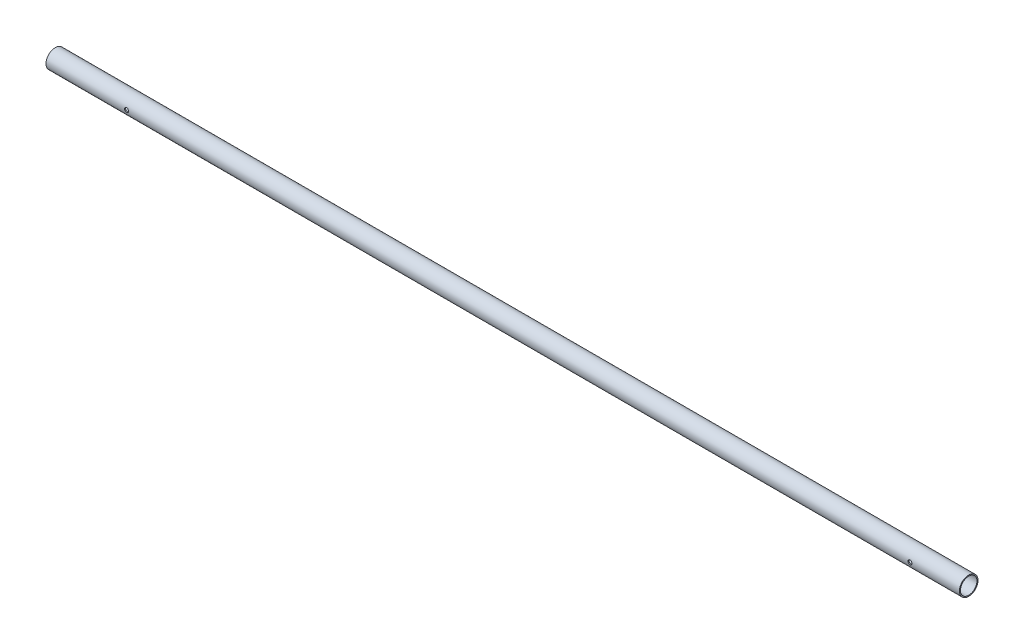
SolidWorks part; units mm, degrees
ref_plane "Front Plane" through (0, 0, 0) normal (0, 0, 1) x (1, 0, 0)
ref_plane "Top Plane" through (0, 0, 0) normal (0, 1, 0) x (1, 0, 0)
ref_plane "Right Plane" through (0, 0, 0) normal (1, 0, 0) x (0, 0, -1)
sketch "Sketch1" plane through (0, 0, 0) normal (1, 0, 0) x (0, 0, -1)
  circle A0 centre (0, 0) radius 19.05
  circle A1 centre (0, 0) radius 16.9418
  dimension "D1" = 38.1
  dimension "D2" = 2.1082
extrude "Extrude1" add sketch "Sketch1" along normal mid plane 1873.25
sketch "Sketch2" plane through (0, 0, 0) normal (0, 0, 1) x (1, 0, 0)
  line L0 (-988.3817, 0) -> (1209.6111, 0) construction
  line L1 (-936.625, 19.05) -> (-936.625, -19.05) construction
  circle A0 centre (-771.525, 0) radius 4.1656
  circle A1 centre (835.025, 0) radius 4.1656
  dimension "D1" = 8.3312
  dimension "D2" = 8.3312
  dimension "D3" = 165.1
  dimension "D4" = 1771.65
extrude "Extrude2" cut sketch "Sketch2" against normal through all and the other way through all
